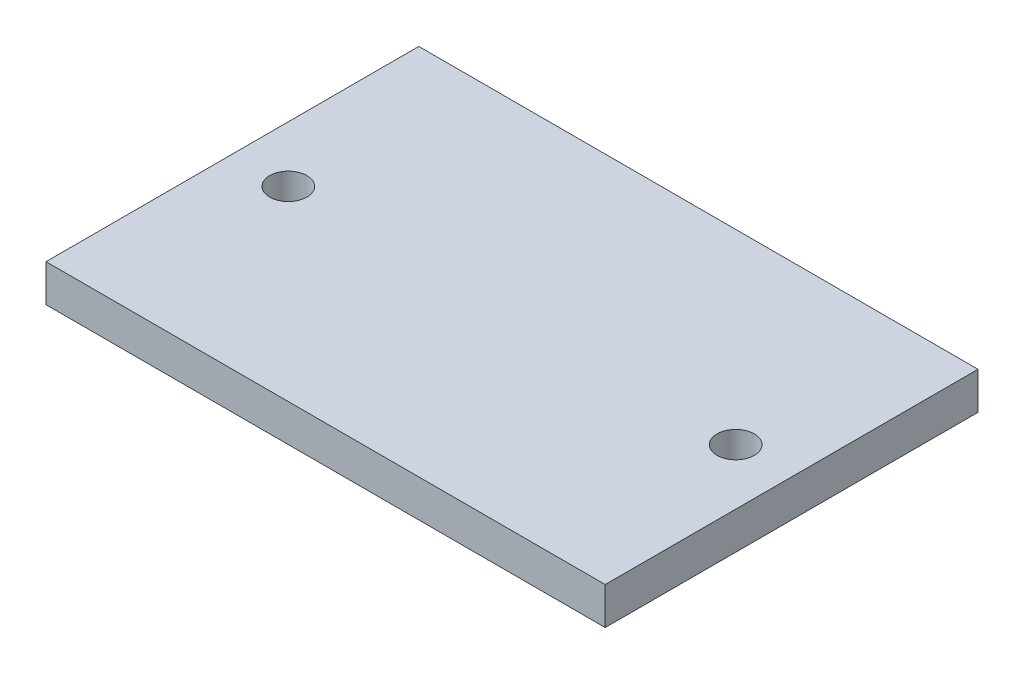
SolidWorks part; units mm, degrees
ref_plane "Front" through (0, 0, 0) normal (0, 0, 1) x (1, 0, 0)
ref_plane "Top" through (0, 0, 0) normal (0, 1, 0) x (1, 0, 0)
ref_plane "Right" through (0, 0, 0) normal (1, 0, 0) x (0, 0, -1)
sketch "Sketch1" plane through (0, 0, 0) normal (0, 1, 0) x (1, 0, 0)
  line L0 (75, -50) -> (-75, 50) construction
  line L1 (-75, 50) -> (75, 50)
  line L2 (-75, 50) -> (-75, -50)
  line L3 (-75, -50) -> (75, -50)
  line L4 (75, 50) -> (75, -50)
  dimension "D1" = 150
  dimension "D2" = 100
extrude "Extrude1" add sketch "Sketch1" along normal blind 10
sketch "Sketch3" plane through (0, 10, 0) normal (0, 1, 0) x (-1, 0, 0)
  line L0 (75, -50) -> (75, 50) construction
  circle A0 centre (60, 0) radius 5
  dimension "D2" = 10
  dimension "D1" = 15
extrude "Cut-Extrude1" cut sketch "Sketch3" against normal through all
pattern_linear "LPattern1" count 2 spacing 120
